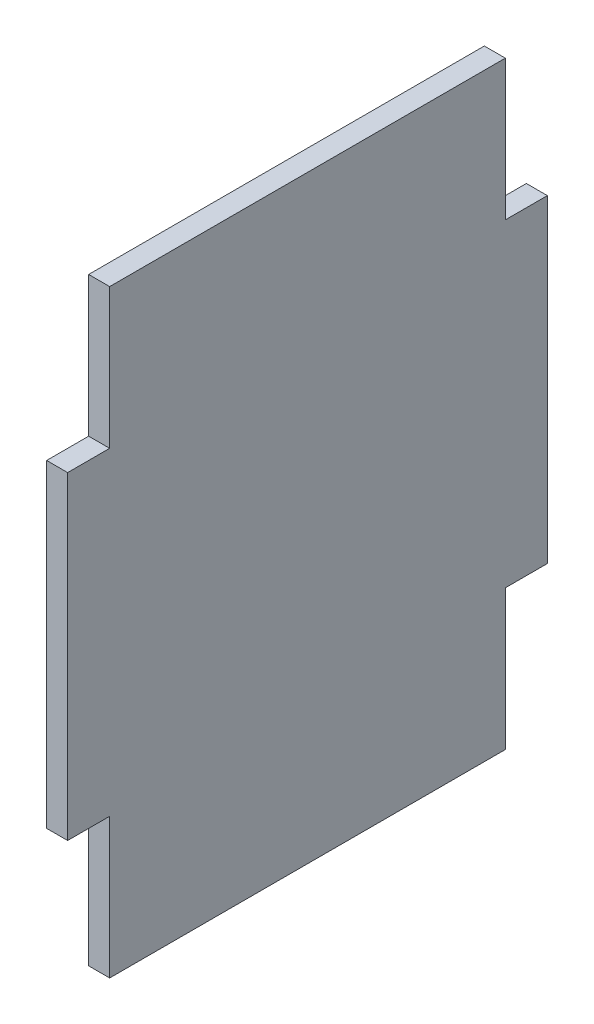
SolidWorks part; units mm, degrees
ref_plane "Plan de face" through (0, 0, 0) normal (0, 0, 1) x (1, 0, 0)
ref_plane "Plan de dessus" through (0, 0, 0) normal (0, 1, 0) x (1, 0, 0)
ref_plane "Plan de droite" through (0, 0, 0) normal (1, 0, 0) x (0, 0, -1)
sketch "Esquisse1" plane through (0, 0, 0) normal (1, 0, 0) x (0, 0, -1)
  line L1 (-68.5, 85.5) -> (68.5, 85.5)
  line L2 (-68.5, 85.5) -> (-68.5, -85.5)
  line L3 (-68.5, -85.5) -> (68.5, -85.5)
  line L4 (68.5, 85.5) -> (68.5, -85.5)
  line L5 (-68.5, 85.5) -> (68.5, -85.5) construction
  line L6 (-68.5, -85.5) -> (68.5, 85.5) construction
  point P0 (0, 0)
  dimension "D1" = 171
  dimension "D2" = 137
extrude "Boss.-Extru.1" add sketch "Esquisse1" along normal blind 6
sketch "Esquisse2" plane through (6, 0, 0) normal (1, 0, 0) x (0, 0, -1)
  line L1 (-68.5, 85.5) -> (-56.5, 85.5)
  line L2 (-68.5, 85.5) -> (-68.5, 45.5)
  line L3 (-68.5, 45.5) -> (-56.5, 45.5)
  line L4 (-56.5, 85.5) -> (-56.5, 45.5)
  dimension "D1" = 40
  dimension "D2" = 12
extrude "Enlèv. mat.-Extru.1" cut sketch "Esquisse2" against normal blind 6
mirror "Symétrie1" about plane through (0, 0, 0) normal (0, 1, 0) of "Enlèv. mat.-Extru.1"
mirror "Symétrie2" about plane through (0, 0, 0) normal (0, 0, 1) of "Symétrie1", "Enlèv. mat.-Extru.1"
